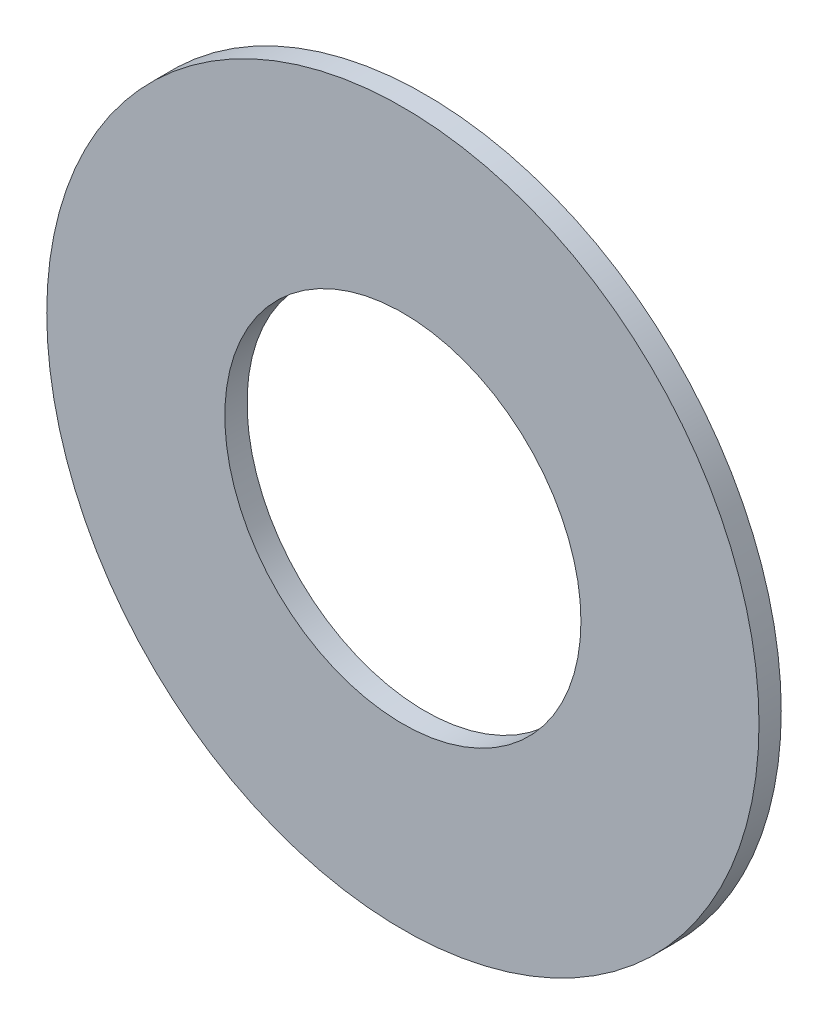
SolidWorks part; units mm, degrees
ref_plane "Plan1" through (0, 0, 0) normal (0, 0, 1) x (1, 0, 0)
ref_plane "Plan2" through (0, 0, 0) normal (0, 1, 0) x (1, 0, 0)
ref_plane "Plan3" through (0, 0, 0) normal (1, 0, 0) x (0, 0, -1)
sketch "Esquisse1" plane through (0, 0, 0) normal (0, 0, 1) x (1, 0, 0)
  circle A0 centre (0, 24.7771) radius 4 construction
  circle A1 centre (0, 24.7771) radius 4
  circle A2 centre (0, 24.7771) radius 8
  dimension "D1" = 4
extrude "Base-Extrusion" add sketch "Esquisse1" along normal blind 0.5
